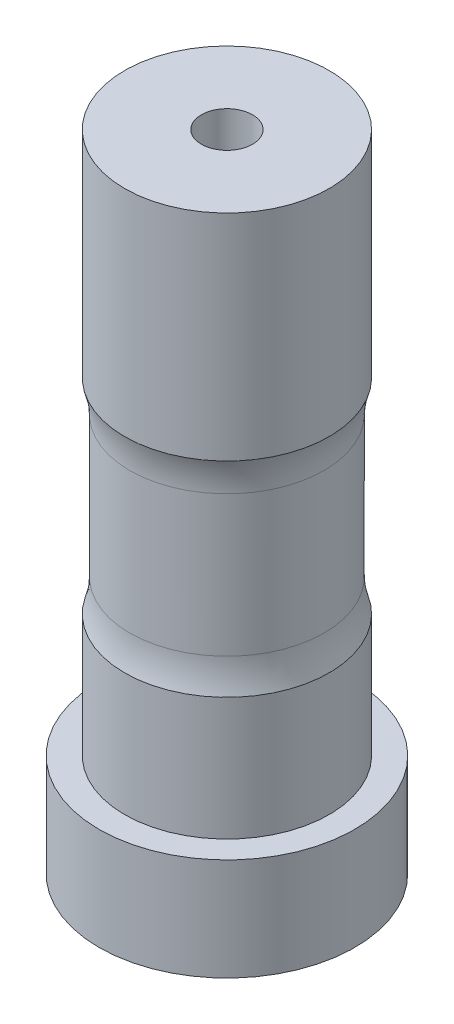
SolidWorks part; units mm, degrees
ref_plane "Plan de face" through (0, 0, 0) normal (0, 0, 1) x (1, 0, 0)
ref_plane "Plan de dessus" through (0, 0, 0) normal (0, 1, 0) x (1, 0, 0)
ref_plane "Plan de droite" through (0, 0, 0) normal (1, 0, 0) x (0, 0, -1)
sketch "Esquisse1" plane through (0, 0, 0) normal (1, 0, 0) x (0, 0, -1)
  line L0 (0, 35.3991) -> (0, -29.1009) construction
  line L1 (10, 35.3991) -> (0, 35.3991)
  line L2 (10, 35.3991) -> (10, 14.3991)
  line L3 (10, -17.6009) -> (12.5, -17.6009)
  line L4 (12.5, -17.6009) -> (12.5, -27.6009)
  line L5 (12.5, -27.6009) -> (10, -27.6009)
  line L6 (10, -27.6009) -> (10, -29.1009)
  line L7 (10, -29.1009) -> (0, -29.1009)
  line L8 (0, -29.1009) -> (0, 35.3991)
  line L9 (10, 14.3991) -> (9.5, 14.3991)
  line L10 (10, -17.6009) -> (10, -5.6009)
  line L11 (10, -5.6009) -> (9.5, -5.6009)
  line L12 (9.5, 14.3991) -> (9.5, -5.6009)
  dimension "D1" = 64.5
  dimension "D2" = 2.5
  dimension "D3" = 10
  dimension "D5" = 10
  dimension "D6" = 2.5
  dimension "D8" = 10
  dimension "D9" = 1.5
revolve "Révolution1" add sketch "Esquisse1" angle 360 about L0
sketch "Esquisse3" plane through (0, 35.3991, 0) normal (0, 1, 0) x (-1, 0, 0)
  circle A0 centre (0, 0) radius 2.6
  dimension "D1" = 5.2
extrude "Extrusion3" [suppressed] cut sketch "Esquisse3" against normal blind 20
fillet "Congé1" radius 10 2 edges at (0, -5.6009, 9.5) (0, 14.3991, 9.5)
hole_wizard "Trou pour taraudage pour trou taraudé M61" positions "Esquisse3D2" profile "Esquisse5" hole size "M6" standard "ISO"
sketch3d "Esquisse3D2"
  point P0 (0, 0, 0)
  point P3 (0, 35.3991, 0)
sketch "Esquisse5" plane through (0, 35.3991, 0) normal (1, 0, 0) x (0, 0, 1)
  line L0 (0, 0) -> (0, 21.5022)
  line L1 (0, 21.5022) -> (2.5, 20)
  line L2 (2.5, 20) -> (2.5, 0)
  line L5 (2.5, 0) -> (0, 0)
  line L10 (0, 21.5022) -> (-2.5, 20) construction
  line L11 (0, -6.35) -> (0, 107.95) construction
  dimension "Diamètre du perçage" = 5
  dimension "Profondeur du perçage" = 20
  dimension "Angle de pointe" = 118
